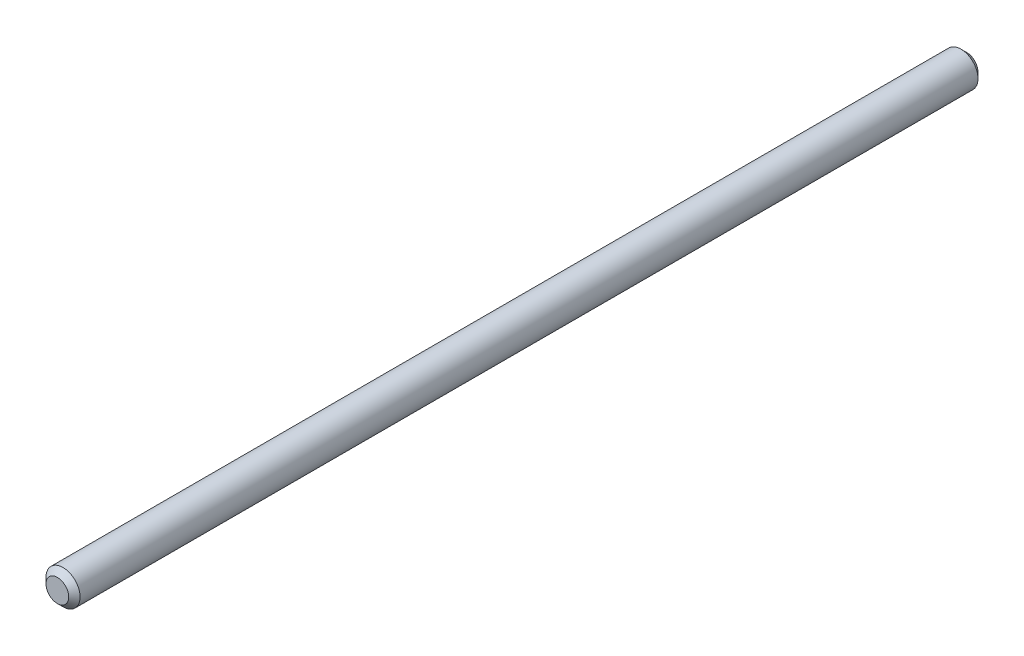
SolidWorks part; units mm, degrees
ref_plane "Face" through (0, 0, 0) normal (0, 0, 1) x (1, 0, 0)
ref_plane "Dessus" through (0, 0, 0) normal (0, 1, 0) x (1, 0, 0)
ref_plane "Droite" through (0, 0, 0) normal (1, 0, 0) x (0, 0, -1)
sketch "Esquisse1" plane through (0, 0, 0) normal (0, 0, 1) x (1, 0, 0)
  circle A0 centre (0, 0) radius 1.5
extrude "Base-Extrusion" add sketch "Esquisse1" along normal blind 80
chamfer "Chanfrein1" distance 0.5 angle 45 2 edges at (1.5, 0, 0) (1.5, 0, 80)
